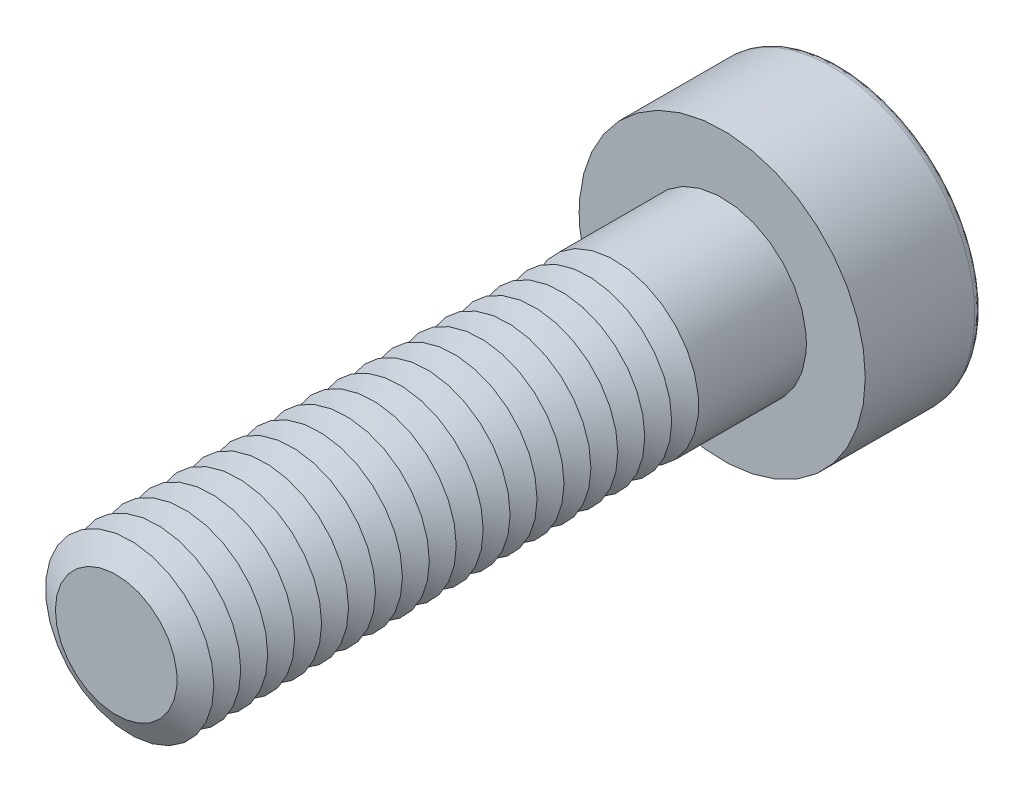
SolidWorks part; units mm, degrees
ref_plane "Front Plane" through (0, 0, 0) normal (0, 0, 1) x (1, 0, 0)
ref_plane "Top Plane" through (0, 0, 0) normal (0, 1, 0) x (1, 0, 0)
ref_plane "Right Plane" through (0, 0, 0) normal (1, 0, 0) x (0, 0, -1)
sketch "Sketch1" plane through (0, 0, 0) normal (0, 0, 1) x (1, 0, 0)
  circle A0 centre (0, 0) radius 2.5
  dimension "D1" = 5
extrude "Boss-Extrude1" add sketch "Sketch1" along normal blind 18
sketch "Sketch2" plane through (0, 0, 0) normal (0, 0, -1) x (-1, 0, 0)
  circle A0 centre (0, 0) radius 4.25
  dimension "D1" = 8.5
extrude "Boss-Extrude2" add sketch "Sketch2" along normal blind 3.5
sketch "Sketch3" plane through (0, 0, -3.5) normal (0, 0, -1) x (-1, 0, 0)
  line L1 (-0.866, 1.5) -> (-1.7321, 0)
  line L2 (-1.7321, 0) -> (-0.866, -1.5)
  line L3 (-0.866, -1.5) -> (0.866, -1.5)
  line L4 (0.866, -1.5) -> (1.7321, 0)
  line L5 (1.7321, 0) -> (0.866, 1.5)
  line L6 (0.866, 1.5) -> (-0.866, 1.5)
  circle A0 centre (0, 0) radius 1.5 construction
  dimension "D1" = 3
extrude "Cut-Extrude1" cut sketch "Sketch3" against normal blind 2.25
fillet "Fillet1" radius 0.25 1 edges at (-4.25, 0, -3.5)
sketch "Sketch4" plane through (0, 0, -1.25) normal (0, 0, -1) x (-1, 0, 0)
  line L0 (0.866, -1.5) -> (1.7321, 0) construction
  circle A0 centre (0, 0) radius 1.5
extrude "Cut-Extrude2" cut sketch "Sketch4" against normal through all draft 60
sketch "Sketch5" plane through (0, 0, -3.5) normal (0, 0, -1) x (-1, 0, 0)
  circle A0 centre (0, 0) radius 1.7321
extrude "Cut-Extrude3" cut sketch "Sketch5" against normal through all draft 75
sketch "Sketch7" plane through (0, 0, 0) normal (1, 0, 0) x (0, 0, -1)
  line L25 (-18, 1.8072) -> (-17.6, 2.5)
  line L26 (-18, 2.5) -> (-18, -2.5) construction
  line L27 (-17.6, 2.5) -> (-18.4, 2.5)
  line L28 (-18.4, 2.5) -> (-18, 1.8072)
  line L29 (0, 2.5) -> (-18, 2.5) construction
  dimension "D1" = 0.8
revolve "Cut-Revolve1" cut sketch "Sketch7" angle 360 about axis through (0, 0, 18) along (0, 0, -1)
pattern_linear "LPattern1" count 19 spacing 0.8 along (0, 0, -1) of "Cut-Revolve1"
